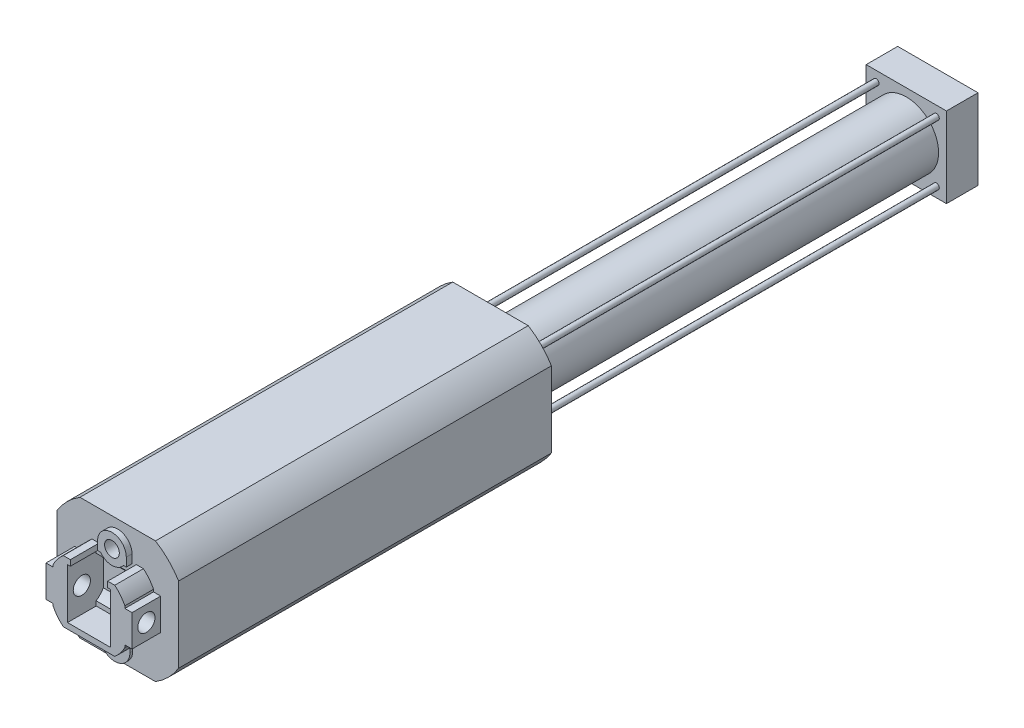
SolidWorks part; units mm, degrees
ref_plane "Plan1" through (0, 0, 0) normal (0, 0, 1) x (1, 0, 0)
ref_plane "Plan2" through (0, 0, 0) normal (0, 1, 0) x (1, 0, 0)
ref_plane "Plan3" through (0, 0, 0) normal (1, 0, 0) x (0, 0, -1)
sketch "Esquisse1" plane through (0, 0, 0) normal (0, 0, 1) x (1, 0, 0)
  circle A0 centre (0, 0) radius 50
  dimension "D5" = 100
extrude "Base-Extrusion" add sketch "Esquisse1" along normal blind 260
sketch "Esquisse2" plane through (0, 0, 260) normal (0, 0, 1) x (1, 0, 0)
  line L1 (-42.5, 42.5) -> (42.5, 42.5)
  line L2 (-42.5, 42.5) -> (-42.5, -42.5)
  line L3 (-42.5, -42.5) -> (42.5, -42.5)
  line L4 (42.5, 42.5) -> (42.5, -42.5)
  dimension "D1" = 42.5
  dimension "D2" = 42.5
  dimension "D3" = 42.5
  dimension "D4" = 42.5
extrude "Enlèv. mat.-Extru.1" cut sketch "Esquisse2" against normal through all flip side to cut
sketch "Esquisse3" plane through (0, 0, 260) normal (0, 0, 1) x (1, 0, 0)
  circle A0 centre (0, 0) radius 28
  dimension "D1" = 56
extrude "Boss.-Extru.1" add sketch "Esquisse3" along normal blind 20
sketch "Esquisse4" plane through (0, 0, 280) normal (0, 0, 1) x (1, 0, 0)
  line L1 (-25, 21.5) -> (25, 21.5)
  line L2 (-25, 21.5) -> (-25, -21.5)
  line L3 (-25, -21.5) -> (25, -21.5)
  line L4 (25, 21.5) -> (25, -21.5)
  dimension "D1" = 25
  dimension "D2" = 25
  dimension "D3" = 21.5
  dimension "D4" = 21.5
extrude "Enlèv. mat.-Extru.4" cut sketch "Esquisse4" against normal blind 20 flip side to cut
sketch "Esquisse5" plane through (0, 0, 280) normal (0, 0, 1) x (1, 0, 0)
  line L0 (-13, 21.5) -> (-13, 17.5)
  line L1 (17.9374, 21.5) -> (-17.9374, 21.5) construction
  line L2 (-13, 17.5) -> (-15, 17.5)
  line L3 (-15, 17.5) -> (-15, -17.5)
  line L4 (-15, -17.5) -> (15, -17.5)
  line L5 (15, -17.5) -> (15, 17.5)
  line L6 (15, 17.5) -> (13, 17.5)
  line L7 (13, 17.5) -> (13, 21.5)
  line L8 (13, 21.5) -> (-13, 21.5)
  dimension "D1" = 15
  dimension "D2" = 15
  dimension "D3" = 13
  dimension "D4" = 13
  dimension "D5" = 17.5
  dimension "D6" = 17.5
extrude "Enlèv. mat.-Extru.5" cut sketch "Esquisse5" against normal blind 20
sketch "Esquisse6" plane through (25, 0, 0) normal (1, 0, 0) x (0, 0, -1)
  line L2 (-280, -12.6095) -> (-280, 12.6095) construction
  line L3 (-280, -11) -> (-260, -11)
  line L4 (-280, -11) -> (-280, 11)
  line L5 (-280, 11) -> (-260, 11)
  line L6 (-260, -11) -> (-260, 11)
  line L7 (-260, -26.3391) -> (-260, 26.3391) construction
  dimension "D2" = 11
  dimension "D1" = 11
extrude "Boss.-Extru.2" add sketch "Esquisse6" along normal blind 5
sketch "Esquisse7" plane through (-25, 0, 0) normal (-1, 0, 0) x (0, 0, 1)
  line L0 (260, 26.3391) -> (260, -26.3391) construction
  line L1 (260, 11) -> (280, 11)
  line L2 (260, 11) -> (260, -11)
  line L3 (260, -11) -> (280, -11)
  line L4 (280, 11) -> (280, -11)
  line L5 (280, 12.6095) -> (280, 21.5) construction
  dimension "D1" = 11
  dimension "D2" = 11
extrude "Boss.-Extru.3" add sketch "Esquisse7" along normal blind 5
sketch "Esquisse8" plane through (-30, 0, 0) normal (-1, 0, 0) x (0, 0, 1)
  line L0 (280, 0) -> (260, 0) construction
  circle A0 centre (270, 0) radius 6
  dimension "D2" = 12
  dimension "D1" = 10
extrude "Enlèv. mat.-Extru.6" cut sketch "Esquisse8" against normal through all
sketch "Esquisse9" plane through (-15, 0, 0) normal (1, 0, 0) x (0, 0, -1)
  line L0 (-280, 0) -> (-260, 0) construction
  line L1 (-255, -9.0139) -> (-255, 9.0139)
  arc A0 (-255, 9.0139) -> (-255, -9.0139) centre (-270, 0) ccw
  circle A1 centre (-270, 0) radius 6 construction
  dimension "D1" = 17.5
  dimension "D2" = 15
extrude "Enlèv. mat.-Extru.7" cut sketch "Esquisse9" along normal blind 30
sketch "Esquisse10" plane through (0, 0, 260) normal (0, 0, 1) x (1, 0, 0)
  line L0 (-10.5, -31.9975) -> (-10.5, -21.5)
  line L1 (-17.9374, -21.5) -> (17.9374, -21.5) construction
  line L2 (-10.5, -21.5) -> (10.5, -21.5)
  line L3 (10.5, -21.5) -> (10.5, -31.9975)
  line L4 (15, -17.5) -> (15, 17.5) construction
  line L5 (-15, 17.5) -> (-15, -17.5) construction
  arc A2 (-10.5, -31.9975) -> (10.5, -31.9975) centre (0, -31.9975) ccw
  dimension "D3" = 10.5
  dimension "D2" = 10.4975
extrude "Boss.-Extru.4" add sketch "Esquisse10" along normal blind 2
sketch "Esquisse11" plane through (0, 0, 260) normal (0, 0, 1) x (1, 0, 0)
  line L0 (-10, 20.5) -> (-8, 20.5)
  line L1 (-10, 26.5) -> (-10, 20.5)
  line L2 (10, 26.5) -> (10, 20.5)
  line L3 (8, 20.5) -> (10, 20.5)
  arc A0 (-8, 20.5) -> (8, 20.5) centre (0, 26.5) ccw
  arc A1 (10, 26.5) -> (-10, 26.5) centre (0, 26.5) ccw
  dimension "D3" = 10
  dimension "D1" = 26.5
  dimension "D2" = 6
extrude "Boss.-Extru.5" add sketch "Esquisse11" along normal blind 4
sketch "Esquisse12" plane through (0, 0, 262) normal (0, 0, 1) x (1, 0, 0)
  circle A0 centre (0, -31.9975) radius 5.125
  arc A1 (-10.5, -31.9975) -> (10.5, -31.9975) centre (0, -31.9975) ccw construction
  dimension "D1" = 10.25
extrude "Enlèv. mat.-Extru.8" cut sketch "Esquisse12" against normal blind 10
sketch "Esquisse13" plane through (0, 0, 264) normal (0, 0, 1) x (1, 0, 0)
  circle A0 centre (0, 26.5) radius 5.125
  arc A1 (10, 26.5) -> (-10, 26.5) centre (0, 26.5) ccw construction
  dimension "D1" = 10.25
extrude "Enlèv. mat.-Extru.9" cut sketch "Esquisse13" against normal blind 10
sketch "Esquisse14" plane through (0, 0, 0) normal (0, 0, -1) x (-1, 0, 0)
  circle A0 centre (0, 0) radius 22.5
  dimension "D1" = 45
extrude "Boss.-Extru.6" add sketch "Esquisse14" along normal blind 290
sketch "Esquisse15" plane through (0, 0, -290) normal (0, 0, -1) x (-1, 0, 0)
  line L1 (-28, 28) -> (28, 28)
  line L2 (-28, 28) -> (-28, -28)
  line L3 (-28, -28) -> (28, -28)
  line L4 (28, 28) -> (28, -28)
  dimension "D1" = 28
  dimension "D2" = 28
  dimension "D3" = 28
  dimension "D4" = 28
extrude "Boss.-Extru.7" add sketch "Esquisse15" along normal blind 22
sketch "Esquisse16" plane through (0, 0, -312) normal (0, 0, -1) x (-1, 0, 0)
  circle A0 centre (0, 0) radius 14
  dimension "D1" = 28
extrude "Boss.-Extru.8" add sketch "Esquisse16" along normal blind 6
sketch "Esquisse17" plane through (0, 0, -290) normal (0, 0, 1) x (1, 0, 0)
  circle A0 centre (21, 21) radius 2
  circle A1 centre (-21, 21) radius 2
  circle A2 centre (-21, -21) radius 2
  circle A3 centre (21, -21) radius 2
  dimension "D5" = 4
  dimension "D6" = 4
  dimension "D7" = 4
  dimension "D8" = 4
  dimension "D1" = 21
  dimension "D2" = 21
  dimension "D3" = 21
  dimension "D4" = 21
extrude "Boss.-Extru.9" add sketch "Esquisse17" along normal up to next
sketch "Esquisse18" plane through (0, 0, -318) normal (0, 0, -1) x (-1, 0, 0)
  circle A0 centre (0, 0) radius 8
  dimension "D1" = 16
extrude "Enlèv. mat.-Extru.10" cut sketch "Esquisse18" against normal blind 500
sketch "Esquisse20" plane through (0, 0, 182) normal (0, 0, -1) x (-1, 0, 0)
  circle A0 centre (0, 0) radius 40
  dimension "D1" = 80
extrude "Enlèv. mat.-Extru.11" cut sketch "Esquisse20" against normal blind 64.0614 and the other way blind 170
